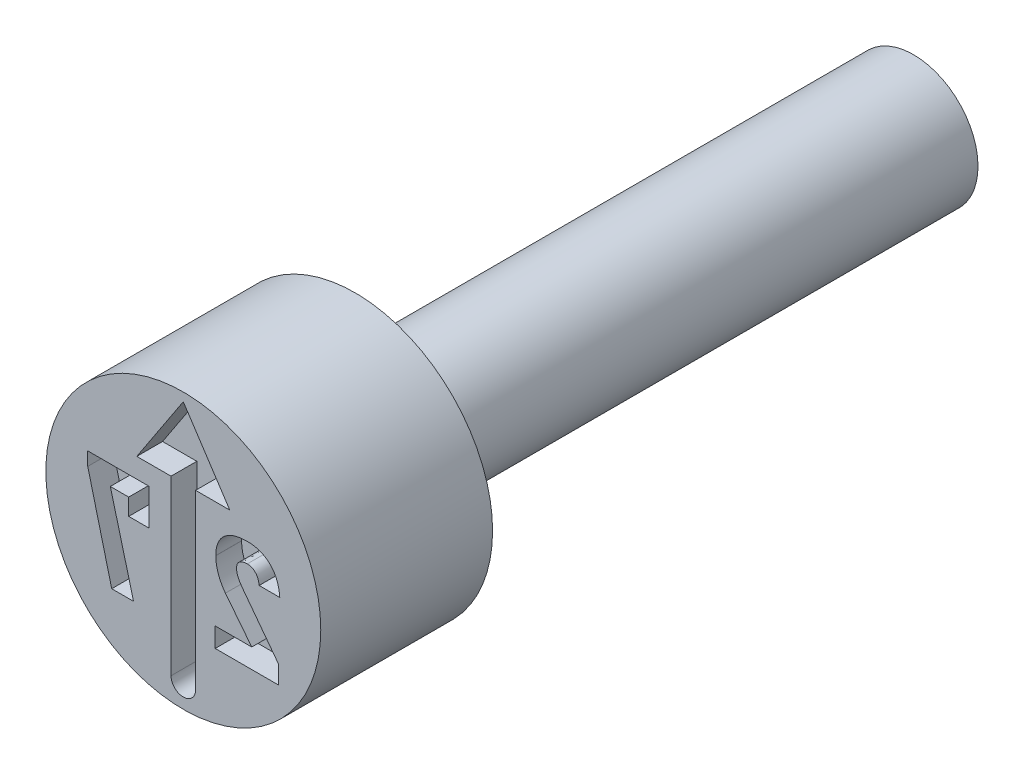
SolidWorks part; units mm, degrees
ref_plane "Front Plane" through (0, 0, 0) normal (0, 0, 1) x (1, 0, 0)
ref_plane "Top Plane" through (0, 0, 0) normal (0, 1, 0) x (1, 0, 0)
ref_plane "Right Plane" through (0, 0, 0) normal (1, 0, 0) x (0, 0, -1)
sketch "Sketch2" plane through (0, 0, 0) normal (1, 0, 0) x (0, 0, -1)
  line L0 (0.4039, 0) -> (50000.4039, 0) construction
  line L6 (0, 3.2) -> (0, 0)
  line L7 (4, 3.2) -> (0, 3.2)
  line L8 (4, 1.5) -> (4, 3.2)
  line L9 (17, 1.5) -> (4, 1.5)
  line L10 (17, 0) -> (17, 1.5)
  line L11 (0, 0) -> (17, 0)
  dimension "D1" = 6.4
  dimension "D2" = 3
  dimension "D3" = 17
  dimension "D4" = 4
revolve "Revolve1" add sketch "Sketch2" angle 360 about L0
sketch "Sketch3" plane through (0, 0, 0) normal (0, 0, 1) x (1, 0, 0)
  line L0 (0, 0) -> (0, 150000) construction
  line L1 (0.2857, 1.3595) -> (0.2857, -2.6642)
  line L2 (1.0829, 1.3595) -> (0.2857, 1.3595)
  line L3 (0, 3.0032) -> (1.0829, 1.3595)
  line L15 (0, 3.0032) -> (-1.0829, 1.3595)
  line L16 (-1.0829, 1.3595) -> (-0.2857, 1.3595)
  line L17 (-0.2857, 1.3595) -> (-0.2857, -2.6642)
  arc A2 (-0.2857, -2.6642) -> (0.2857, -2.6642) centre (0, -2.6642) ccw
extrude "Cut-Extrude4" cut sketch "Sketch3" against normal blind 0.6
sketch "Sketch4" plane through (0, 0, 0) normal (0, 0, 1) x (1, 0, 0)
  text T0 "2  7" font "Bahnschrift" height 2.5
  dimension "D1" = 1.6
  dimension "D2" = 2.4
extrude "Cut-Extrude5" cut sketch "Sketch4" against normal blind 0.6
